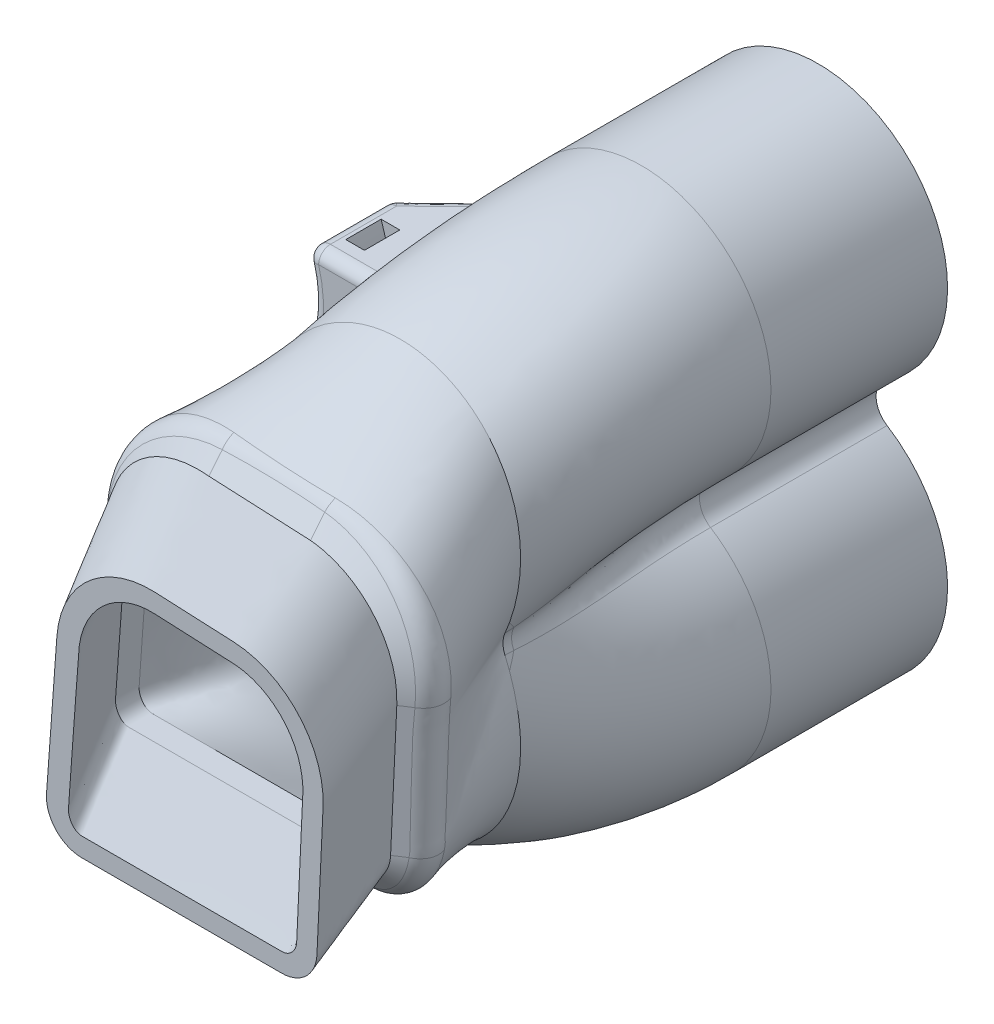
SolidWorks part; units mm, degrees
other "Твердое тело1[1]"
ref_plane "Спереди" through (0, 0, 0) normal (0, 0, 1) x (1, 0, 0)
ref_plane "Сверху" through (0, 0, 0) normal (0, 1, 0) x (1, 0, 0)
ref_plane "Справа" through (0, 0, 0) normal (1, 0, 0) x (0, 0, -1)
other "Configuration Table"
sketch "Эскиз1" plane through (0, 0, 0) normal (0, 0, 1) x (1, 0, 0)
  line L0 (-10.1901, -13.6844) -> (8.791, -13.6844)
  line L1 (13.7856, -8.9175) -> (14.3125, 2.3726)
  line L2 (4.7895, 12.8279) -> (-3.836, 13.2305)
  line L3 (-14.2753, 3.9727) -> (-15.1767, -8.3187)
  line L4 (-15.2035, -8.6844) -> (13.7965, -8.6844) construction
  line L5 (7.1965, -13.6844) -> (7.1965, 12.7156) construction
  line L6 (14.4965, 6.3156) -> (-14.1035, 6.3156) construction
  line L7 (-13.5631, 13.6844) -> (13.5631, -13.6844) construction
  arc A0 (8.791, -13.6844) -> (13.7856, -8.9175) centre (8.791, -8.6844) ccw
  arc A1 (-10.1901, -13.6844) -> (-15.1767, -8.3187) centre (-10.1901, -8.6844) cw
  arc A2 (-3.836, 13.2305) -> (-14.2753, 3.9727) centre (-4.3021, 3.2413) ccw
  arc A3 (14.3125, 2.3726) -> (4.7895, 12.8279) centre (4.3233, 2.8388) ccw
  point P8 (0, 0)
  dimension "D8" = 5
  dimension "D9" = 5
  dimension "D10" = 10
  dimension "D11" = 10
  dimension "D1" = 29
  dimension "D2" = 5
  dimension "D3" = 6.6
  dimension "D4" = 7.3
  dimension "D5" = 20
  dimension "D6" = 21.3
  dimension "D7" = 26.4
sketch "Эскиз14" plane through (0, 0, 0) normal (0, 0, 1) x (1, 0, 0)
  line L9 (-12.2807, 3.8264) -> (-13.1821, -8.465)
  line L10 (-10.1901, -11.6844) -> (8.791, -11.6844)
  line L11 (11.7878, -8.8242) -> (12.3146, 2.4659)
  line L12 (4.6963, 10.8301) -> (-3.9292, 11.2326)
  line L13 (-12.2807, 3.8264) -> (-13.1821, -8.465)
  line L14 (-10.1901, -11.6844) -> (8.791, -11.6844)
  line L15 (11.7878, -8.8242) -> (12.3146, 2.4659)
  line L16 (4.6963, 10.8301) -> (-3.9292, 11.2326)
  arc A8 (-13.1821, -8.465) -> (-10.1901, -11.6844) centre (-10.1901, -8.6844) ccw
  arc A9 (8.791, -11.6844) -> (11.7878, -8.8242) centre (8.791, -8.6844) ccw
  arc A10 (12.3146, 2.4659) -> (4.6963, 10.8301) centre (4.3233, 2.8388) ccw
  arc A11 (-3.9292, 11.2326) -> (-12.2807, 3.8264) centre (-4.3021, 3.2413) ccw
  arc A12 (-13.1821, -8.465) -> (-10.1901, -11.6844) centre (-10.1901, -8.6844) ccw
  arc A13 (8.791, -11.6844) -> (11.7878, -8.8242) centre (8.791, -8.6844) ccw
  arc A14 (12.3146, 2.4659) -> (4.6963, 10.8301) centre (4.3233, 2.8388) ccw
  arc A15 (-3.9292, 11.2326) -> (-12.2807, 3.8264) centre (-4.3021, 3.2413) ccw
  dimension "D1" = 2
sketch "Эскиз15" plane through (0, 0, 0) normal (0, 1, 0) x (1, 0, 0)
  line L0 (-12.5613, 0) -> (-6.5613, -10)
  line L1 (12.1996, 0) -> (12.1996, -10) construction
  line L2 (12.1996, -10) -> (16.1996, -10) construction
  line L3 (-12.5613, 0) -> (-12.5613, -10) construction
  line L4 (-12.5613, -10) -> (-6.5613, -10) construction
  line L5 (16.1996, -10) -> (12.1996, 0)
  dimension "D1" = 10
  dimension "D2" = 6
  dimension "D3" = 4
ref_plane "Плоскость6" through (0, 0, 10) normal (0, 0, 1) x (1, 0, 0)
sketch "Эскиз21" plane through (0, 0, 10) normal (0, 0, 1) x (1, 0, 0)
  line L0 (-10.1901, -11.6844) -> (8.791, -11.6844) construction
  line L1 (4.6963, 10.8301) -> (-3.9292, 11.2326) construction
  line L8 (15.7878, -8.8242) -> (16.306, 2.2796)
  line L9 (8.6876, 10.6438) -> (2.0503, 10.9536)
  line L10 (-6.3012, 3.5474) -> (-7.1821, -8.465)
  line L11 (-4.1901, -11.6844) -> (12.791, -11.6844)
  arc A8 (16.306, 2.2796) -> (8.6876, 10.6438) centre (8.3147, 2.6525) ccw
  arc A9 (2.0503, 10.9536) -> (-6.3012, 3.5474) centre (1.6774, 2.9623) ccw
  arc A10 (-7.1821, -8.465) -> (-4.1901, -11.6844) centre (-4.1901, -8.6844) ccw
  arc A11 (12.791, -11.6844) -> (15.7878, -8.8242) centre (12.791, -8.6844) ccw
  dimension "D1" = 8
  dimension "D2" = 8
  dimension "D3" = 3
  dimension "D4" = 3
  dimension "D6" = 85.806
  dimension "D8" = 92.672
loft "По сечениям4" add profiles "Эскиз21", "Эскиз14"
shell "Оболочка1" thickness 1.6
extrude "Бобышка-Вытянуть5" add sketch "Эскиз1" against normal blind 2
chamfer "Фаска2" distance 2 angle 54 8 edges at (-14.726, -2.173, 0) (-13.8526, -12.0882, 0) (-10.9371, 10.7231, 0) (-0.6995, -13.6844, 0) (0.4768, 13.0292, 0) (12.2432, -12.3014, 0) (11.7163, 9.5726, 0) (14.049, -3.2724, 0)
sketch "Эскиз16" plane through (0, 0, 0) normal (0, 0, 1) x (1, 0, 0)
  spline S1 degree 3 number of poles 102 (6.4508, 8.8632) -> (6.4508, 8.8632)
  spline S2 degree 3 number of poles 102 (6.4508, 8.8632) -> (6.4508, 8.8632)
  dimension "D1" = 0
extrude "Вырез-Вытянуть1" cut sketch "Эскиз16" against normal blind 2
sketch "Эскиз17" plane through (0, 0, 0) normal (0, 1, 0) x (1, 0, 0)
  line L0 (-15.1767, 2) -> (14.3125, 2) construction
  line L1 (-15.1767, 2) -> (10.2604, 12.1525)
  line L2 (10.2604, 12.1525) -> (14.3125, 2) construction
  line L4 (16.3145, -10) -> (12.1541, 0.424) construction
ref_plane "Плоскость3" through (0, 0, 0) normal (0, -1, 0) x (0.9288, 0, -0.3707)
ref_plane "Плоскость4" through (-2.774, 0, -6.9502) normal (-0.3707, 0, -0.9288) x (0.9288, 0, -0.3707)
ref_plane "Плоскость5" through (-6.4808, 0, -16.2378) normal (-0.3707, 0, -0.9288) x (0.9288, 0, -0.3707)
sketch "Эскиз18" plane through (-6.4808, 0, -16.2378) normal (-0.3707, 0, -0.9288) x (0.9288, 0, -0.3707)
  circle A0 centre (0, 0) radius 8
  circle A1 centre (0, 0) radius 6.4
  dimension "D1" = 16
  dimension "D2" = 1.6
sketch "Эскиз19" plane through (0, 0, -2) normal (0, 0, -1) x (-1, 0, 0)
  line L4 (-8.791, -13.6844) -> (10.1901, -13.6844)
  line L6 (-8.791, -13.6844) -> (10.1901, -13.6844)
  line L24 (15.1767, -8.3187) -> (14.2753, 3.9727)
  line L26 (15.1767, -8.3187) -> (14.2753, 3.9727)
  line L32 (3.836, 13.2305) -> (-4.7895, 12.8279)
  line L33 (3.836, 13.2305) -> (-4.7895, 12.8279)
  line L34 (-14.3125, 2.3726) -> (-13.7856, -8.9175)
  line L35 (-14.3125, 2.3726) -> (-13.7856, -8.9175)
  arc A4 (-13.7856, -8.9175) -> (-8.791, -13.6844) centre (-8.791, -8.6844) ccw
  arc A6 (-13.7856, -8.9175) -> (-8.791, -13.6844) centre (-8.791, -8.6844) ccw
  arc A20 (10.1901, -13.6844) -> (15.1767, -8.3187) centre (10.1901, -8.6844) ccw
  arc A22 (10.1901, -13.6844) -> (15.1767, -8.3187) centre (10.1901, -8.6844) ccw
  arc A28 (14.2753, 3.9727) -> (3.836, 13.2305) centre (4.3021, 3.2413) ccw
  arc A29 (14.2753, 3.9727) -> (3.836, 13.2305) centre (4.3021, 3.2413) ccw
  arc A30 (-4.7895, 12.8279) -> (-14.3125, 2.3726) centre (-4.3233, 2.8388) ccw
  arc A31 (-4.7895, 12.8279) -> (-14.3125, 2.3726) centre (-4.3233, 2.8388) ccw
  dimension "D1" = 0
sketch "Эскиз25" plane through (0, 0, -2) normal (0, 0, -1) x (-1, 0, 0)
  spline S1 degree 3 number of poles 103 (-6.4508, 8.8632) -> (-6.4508, 8.8632)
  spline S2 degree 3 number of poles 103 (-6.4508, 8.8632) -> (-6.4508, 8.8632)
  dimension "D1" = 0
imported_body "Импортированный1"
ref_plane "Плоскость7" through (50.5082, 29.1609, 0) normal (-0.866, -0.5, 0) x (0, 0, 1)
sketch "Эскиз22" plane through (50.5082, 29.1609, 0) normal (-0.866, -0.5, 0) x (0, 0, 1)
  circle A0 centre (38.5207, 40.0781) radius 44.5574
extrude "Вырез-Вытянуть2" cut sketch "Эскиз22" against normal through all
ref_plane "Плоскость8" through (0, 0, -12) normal (0, 0, -1) x (-1, 0, 0)
move or copy body "Тело-Переместить/Копировать1" bodies to move or copy 119 placed by mates yes parameters "D1"=0, "D2"=0, "D3"=0
move or copy body "Тело-Переместить/Копировать4" bodies to move or copy 120 copy no rotation origin (28.214, 62.9582, 0) rotation axis (0, 0, -1) rotation angle 120
move or copy body "Тело-Переместить/Копировать5" bodies to move or copy 123 placed by mates yes parameters "D1"=0, "D2"=0, "D3"=0
move or copy body "Тело-Переместить/Копировать6" bodies to move or copy 124 copy no translate (-27.576, 0, 0) parameters "D1"=27.576, "D2"=0, "D3"=0
sketch "Эскиз23" plane through (0, 0, -12) normal (0, 0, 1) x (1, 0, 0)
  spline S8 degree 3 poles (-475.1847, -2959.6305) (143.391, 3014.3151) (142.6745, -3014.3563) (-474.4803, 2959.7506) knots -48.361959 -48.361959 -48.361959 -48.361959 49.362504 49.362504 49.362504 49.362504 only from (-11.4821, 0.416) to (-11.4821, -0.4164)
  spline S9 degree 3 poles (97.9998, -2996.6284) (90.3479, 56.2211) (-8.2291, 25.6222) (-11.7485, -2.0174) (-11.7795, -2.4201) (-11.804, -3.2262) (-11.7974, -3.6297) (-11.7486, -4.4376) (-11.7059, -4.8435) (-11.5301, -6.0474) (-11.3507, -6.8326) (9.2131, -76.1636) (421.5135, -35.3531) (-2830.4983, -1016.9948) knots -8.340189 -8.340189 -8.340189 -8.340189 0.125 0.125 0.25 0.25 0.375 0.375 0.5 0.5 0.75 0.75 22.968042 22.968042 22.968042 22.968042 only from (-11.4821, -0.4164) to (-10.2923, -9.8784)
  spline S10 degree 3 poles (-1135.1289, -130.2086) (2332.7362, 1966.0536) (-101.5646, 136.8614) (-8.8364, -12.5452) (-8.3903, -13.1573) (-7.6438, -14.024) (-7.3808, -14.3055) (-6.8329, -14.8437) (-6.5491, -15.0994) (-5.6674, -15.8254) (-5.0393, -16.2546) (-4.0285, -16.8053) (-3.6798, -16.9733) (-2.9756, -17.2698) (-2.6182, -17.3996) (-1.5301, -17.7334) (-0.7823, -17.8828) (0.7555, -18.0161) (1.5163, -17.9971) (2.6448, -17.8367) (3.0189, -17.7614) (3.7628, -17.566) (4.1308, -17.446) (5.1988, -17.0288) (5.873, -16.6729) (6.8257, -16.0189) (7.1309, -15.7821) (7.7062, -15.2795) (7.9778, -15.0125) (8.4902, -14.4478) (8.7309, -14.1503) (9.182, -13.5252) (9.3899, -13.2007) (9.9574, -12.2041) (10.2646, -11.5045) (10.7409, -10.0372) (10.903, -9.2896) (11.0401, -8.1535) (11.0684, -7.7722) (11.0917, -7.0043) (11.0865, -6.6182) (11.0246, -5.4737) (10.9225, -4.7216) (-8.4306, 87.7233) (-843.0126, 33.179) (2890.0038, 797.8753) knots -14.391672 -14.391672 -14.391672 -14.391672 0.0625 0.0625 0.125 0.125 0.15625 0.15625 0.1875 0.1875 0.25 0.25 0.28125 0.28125 0.3125 0.3125 0.375 0.375 0.4375 0.4375 0.46875 0.46875 0.5 0.5 0.5625 0.5625 0.59375 0.59375 0.625 0.625 0.65625 0.65625 0.6875 0.6875 0.75 0.75 0.8125 0.8125 0.84375 0.84375 0.875 0.875 0.9375 0.9375 8.656348 8.656348 8.656348 8.656348 only from (-10.2923, -9.8784) to (10.1432, -1.7798)
  spline S11 degree 3 poles (2857.2917, 915.1964) (-3049.2236, -1398.9064) (3030.9413, 1303.2305) (-2820.3996, -987.7826) knots -240.936323 -240.936323 -240.936323 -240.936323 174.252904 174.252904 174.252904 174.252904 only from (10.1432, -1.7798) to (9.7544, -0.8031)
  spline S12 degree 3 poles (2932.6059, 673.8481) (205.6661, 14.6184) (12.9071, -16.3828) (9.6028, -0.2768) (9.5888, -0.1378) (9.5887, 0.1369) (9.6022, 0.2731) (12.1138, 12.615) (129.8111, 9.003) (326.3596, -2980.0497) knots -29.515141 -29.515141 -29.515141 -29.515141 0.25 0.25 0.5 0.5 0.75 0.75 23.351458 23.351458 23.351458 23.351458 only from (9.7544, -0.8031) to (9.7544, 0.8034)
  spline S13 degree 3 poles (-2820.2168, 988.4082) (3030.7027, -1303.9033) (-3048.9782, 1399.5945) (2857.163, -915.8405) knots -173.253799 -173.253799 -173.253799 -173.253799 241.938092 241.938092 241.938092 241.938092 only from (9.7544, 0.8034) to (10.1434, 1.78)
  spline S14 degree 3 poles (2890.126, -796.0581) (-878.8035, -32.9741) (-8.8354, -89.6337) (10.9213, 4.7168) (11.0234, 5.4673) (11.0856, 6.6091) (11.091, 6.9942) (11.0682, 7.7614) (11.0403, 8.1421) (10.9045, 9.2753) (10.7444, 10.0187) (10.3911, 11.1143) (10.2543, 11.4756) (9.9484, 12.1745) (9.609, 12.8539) (9.2016, 13.4941) (8.7583, 14.1135) (8.5173, 14.4144) (7.7451, 15.2724) (7.1744, 15.774) (6.2375, 16.4245) (5.9117, 16.6243) (5.232, 16.9885) (4.8836, 17.15) (3.8201, 17.5713) (3.0836, 17.7706) (1.5565, 17.996) (0.7947, 18.0165) (-0.3458, 17.9229) (-0.7266, 17.8706) (-1.483, 17.7252) (-1.8544, 17.6329) (-2.9495, 17.301) (-3.6561, 17.0056) (-5.0104, 16.2734) (-5.6409, 15.845) (-6.5253, 15.1204) (-6.8099, 14.8652) (-7.3591, 14.3282) (-7.6225, 14.0476) (-8.3723, 13.1806) (-8.8223, 12.566) (-33.3099, -26.7903) (108.41, -193.1924) (1466.6614, 2613.8231) knots -7.83156 -7.83156 -7.83156 -7.83156 0.0625 0.0625 0.125 0.125 0.15625 0.15625 0.1875 0.1875 0.25 0.25 0.28125 0.28125 0.3125 0.34375 0.34375 0.375 0.375 0.4375 0.4375 0.46875 0.46875 0.5 0.5 0.5625 0.5625 0.625 0.625 0.65625 0.65625 0.6875 0.6875 0.75 0.75 0.8125 0.8125 0.84375 0.84375 0.875 0.875 0.9375 0.9375 4.666451 4.666451 4.666451 4.666451 only from (10.1434, 1.78) to (-10.2923, 9.8779)
  spline S15 degree 3 poles (-2834.6592, 1005.1158) (426.2904, 36.72) (9.3117, 76.5113) (-11.351, 6.8308) (-11.5303, 6.0456) (-11.706, 4.8423) (-11.7488, 4.4355) (-11.7975, 3.6266) (-11.804, 3.223) (-11.7794, 2.4176) (-11.7484, 2.0158) (-7.5497, -30.963) (131.5433, -68.0091) (880.2331, 2860.4936) knots -22.076164 -22.076164 -22.076164 -22.076164 0.25 0.25 0.5 0.5 0.625 0.625 0.75 0.75 0.875 0.875 11.034305 11.034305 11.034305 11.034305 only from (-10.2923, 9.8779) to (-11.4821, 0.416)
  spline S16 degree 3 poles (-11.4821, 0.416) (-11.4174, 0.1428) (-11.4174, -0.1432) (-11.4821, -0.4164) knots 0 0 0 0 1 1 1 1
  spline S17 degree 3 poles (-11.4821, -0.4164) (-11.5742, -0.8101) (-11.6461, -1.213) (-11.7485, -2.0174) (-11.7795, -2.4201) (-11.804, -3.2262) (-11.7974, -3.6297) (-11.7486, -4.4376) (-11.7059, -4.8435) (-11.5301, -6.0474) (-11.3507, -6.8326) (-10.893, -8.3755) (-10.6146, -9.133) (-10.2923, -9.8784) knots 0 0 0 0 0.125 0.125 0.25 0.25 0.375 0.375 0.5 0.5 0.75 0.75 1 1 1 1
  spline S18 degree 3 poles (-10.2923, -9.8784) (-9.9869, -10.584) (-9.6349, -11.2587) (-8.8364, -12.5452) (-8.3903, -13.1573) (-7.6438, -14.024) (-7.3808, -14.3055) (-6.8329, -14.8437) (-6.5491, -15.0994) (-5.6674, -15.8254) (-5.0393, -16.2546) (-4.0285, -16.8053) (-3.6798, -16.9733) (-2.9756, -17.2698) (-2.6182, -17.3996) (-1.5301, -17.7334) (-0.7823, -17.8828) (0.7555, -18.0161) (1.5163, -17.9971) (2.6448, -17.8367) (3.0189, -17.7614) (3.7628, -17.566) (4.1308, -17.446) (5.1988, -17.0288) (5.873, -16.6729) (6.8257, -16.0189) (7.1309, -15.7821) (7.7062, -15.2795) (7.9778, -15.0125) (8.4902, -14.4478) (8.7309, -14.1503) (9.182, -13.5252) (9.3899, -13.2007) (9.9574, -12.2041) (10.2646, -11.5045) (10.7409, -10.0372) (10.903, -9.2896) (11.0401, -8.1535) (11.0684, -7.7722) (11.0917, -7.0043) (11.0865, -6.6182) (11.0246, -5.4737) (10.9225, -4.7216) (10.6116, -3.2366) (10.4027, -2.5037) (10.1432, -1.7798) knots 0 0 0 0 0.0625 0.0625 0.125 0.125 0.15625 0.15625 0.1875 0.1875 0.25 0.25 0.28125 0.28125 0.3125 0.3125 0.375 0.375 0.4375 0.4375 0.46875 0.46875 0.5 0.5 0.5625 0.5625 0.59375 0.59375 0.625 0.625 0.65625 0.65625 0.6875 0.6875 0.75 0.75 0.8125 0.8125 0.84375 0.84375 0.875 0.875 0.9375 0.9375 1 1 1 1
  spline S19 degree 3 poles (10.1432, -1.7798) (10.0247, -1.4496) (9.8952, -1.124) (9.7544, -0.8031) knots 0 0 0 0 1 1 1 1
  spline S20 degree 3 poles (9.7544, -0.8031) (9.6988, -0.676) (9.6579, -0.5451) (9.6028, -0.2768) (9.5888, -0.1378) (9.5887, 0.1369) (9.6022, 0.2731) (9.6572, 0.5432) (9.6988, 0.6763) (9.7544, 0.8034) knots 0 0 0 0 0.25 0.25 0.5 0.5 0.75 0.75 1 1 1 1
  spline S21 degree 3 poles (9.7544, 0.8034) (9.8953, 1.1242) (10.0248, 1.4498) (10.1434, 1.78) knots 0 0 0 0 1 1 1 1
  spline S22 degree 3 poles (10.1434, 1.78) (10.4024, 2.5028) (10.6109, 3.2345) (10.9213, 4.7168) (11.0234, 5.4673) (11.0856, 6.6091) (11.091, 6.9942) (11.0682, 7.7614) (11.0403, 8.1421) (10.9045, 9.2753) (10.7444, 10.0187) (10.3911, 11.1143) (10.2543, 11.4756) (9.9484, 12.1745) (9.609, 12.8539) (9.2016, 13.4941) (8.7583, 14.1135) (8.5173, 14.4144) (7.7451, 15.2724) (7.1744, 15.774) (6.2375, 16.4245) (5.9117, 16.6243) (5.232, 16.9885) (4.8836, 17.15) (3.8201, 17.5713) (3.0836, 17.7706) (1.5565, 17.996) (0.7947, 18.0165) (-0.3458, 17.9229) (-0.7266, 17.8706) (-1.483, 17.7252) (-1.8544, 17.6329) (-2.9495, 17.301) (-3.6561, 17.0056) (-5.0104, 16.2734) (-5.6409, 15.845) (-6.5253, 15.1204) (-6.8099, 14.8652) (-7.3591, 14.3282) (-7.6225, 14.0476) (-8.3723, 13.1806) (-8.8223, 12.566) (-9.6297, 11.2685) (-9.9868, 10.5838) (-10.2923, 9.8779) knots 0 0 0 0 0.0625 0.0625 0.125 0.125 0.15625 0.15625 0.1875 0.1875 0.25 0.25 0.28125 0.28125 0.3125 0.34375 0.34375 0.375 0.375 0.4375 0.4375 0.46875 0.46875 0.5 0.5 0.5625 0.5625 0.625 0.625 0.65625 0.65625 0.6875 0.6875 0.75 0.75 0.8125 0.8125 0.84375 0.84375 0.875 0.875 0.9375 0.9375 1 1 1 1
  spline S23 degree 3 poles (-10.2923, 9.8779) (-10.6148, 9.132) (-10.8934, 8.374) (-11.351, 6.8308) (-11.5303, 6.0456) (-11.706, 4.8423) (-11.7488, 4.4355) (-11.7975, 3.6266) (-11.804, 3.223) (-11.7794, 2.4176) (-11.7484, 2.0158) (-11.6463, 1.2142) (-11.5749, 0.8126) (-11.4821, 0.416) knots 0 0 0 0 0.25 0.25 0.5 0.5 0.625 0.625 0.75 0.75 0.875 0.875 1 1 1 1
  dimension "D1" = 0
sketch "Эскиз24" plane through (0, 0, -12) normal (0, 0, 1) x (1, 0, 0)
  spline S8 degree 3 poles (-506.3708, -2955.0795) (137.5377, 16.778) (-0.5705, 24.7724) (-8.5765, -1.4332) (-8.6618, -1.8033) (-8.8444, -2.9265) (-8.8694, -3.6991) (-8.7657, -5.2096) (-8.6388, -5.9543) (-8.352, -7.0577) (-8.2397, -7.4239) (26.2917, -105.3111) (1150.5664, 206.025) (-2678.9494, -1341.0481) knots -8.713357 -8.713357 -8.713357 -8.713357 0.125 0.125 0.25 0.25 0.5 0.5 0.75 0.75 0.875 0.875 34.763984 34.763984 34.763984 34.763984 only from (-8.0543, 0) to (-7.6879, -8.8463)
  spline S9 degree 3 poles (-2767.757, 1135.1469) (1433.198, -163.6336) (20.0851, 116.1973) (-8.5406, 6.333) (-8.6204, 5.9622) (-8.7459, 5.2111) (-8.7916, 4.8291) (-8.8692, 3.6893) (-8.8446, 2.9319) (-8.6607, 1.8005) (-8.5738, 1.425) (4.6659, -41.8319) (359.2274, 45.3598) (2838.4716, 942.0507) knots -37.106405 -37.106405 -37.106405 -37.106405 0.25 0.25 0.375 0.375 0.5 0.5 0.75 0.75 0.875 0.875 15.631374 15.631374 15.631374 15.631374 only from (-7.6884, 8.8461) to (-8.0543, 0)
  spline S10 degree 3 poles (3000.9621, 126.7815) (-631.3335, -186.7526) (23.7544, -53.9695) (7.8548, 9.2133) (7.7832, 9.4552) (7.6215, 9.927) (7.5311, 10.1581) (7.2304, 10.8366) (6.9909, 11.2694) (6.5661, 11.8857) (6.4126, 12.087) (6.0885, 12.4702) (5.9182, 12.6523) (5.3828, 13.1702) (4.9929, 13.4775) (4.3569, 13.8794) (4.1359, 14.0036) (3.6874, 14.2261) (3.2301, 14.4245) (2.7552, 14.5755) (2.2714, 14.7026) (2.0236, 14.7543) (1.2787, 14.8699) (0.7811, 14.8947) (-0.2156, 14.8446) (-0.7183, 14.7689) (-1.6883, 14.5293) (-2.1598, 14.3659) (-2.8473, 14.0575) (-3.073, 13.944) (-3.5104, 13.7003) (-3.7231, 13.5697) (-4.3442, 13.1533) (-4.7358, 12.843) (-5.4758, 12.1598) (-5.8164, 11.794) (-6.4426, 11.0193) (-6.7285, 10.6102) (-31.8913, -30.8467) (194.4854, -226.4304) (606.7502, 2936.3424) knots -7.964177 -7.964177 -7.964177 -7.964177 0.125 0.125 0.15625 0.15625 0.1875 0.1875 0.25 0.25 0.28125 0.28125 0.3125 0.3125 0.375 0.375 0.40625 0.40625 0.4375 0.46875 0.46875 0.5 0.5 0.5625 0.5625 0.625 0.625 0.6875 0.6875 0.71875 0.71875 0.75 0.75 0.8125 0.8125 0.875 0.875 0.9375 0.9375 6.910082 6.910082 6.910082 6.910082 only from (8.1879, 6.0042) to (-7.6884, 8.8461)
  spline S11 degree 3 poles (2907.4658, -753.1561) (-3070.1528, 567.0222) (3064.3707, -584.3733) (-2900.7467, 733.2541) knots -49.400459 -49.400459 -49.400459 -49.400459 41.208201 41.208201 41.208201 41.208201 only from (7.5367, 2.8129) to (8.1879, 6.0042)
  spline S12 degree 3 poles (-2537.9954, 1584.4395) (-592.8413, 261.4027) (-25.6098, -62.4856) (25.3682, 37.578) (-139.6233, 180.7214) (-1666.2281, -2477.7181) knots -67.20224 -67.20224 -67.20224 -67.20224 0.5 0.5 38.921301 38.921301 38.921301 38.921301 only from (6.1036, 0) to (7.5367, 2.8129)
  spline S13 degree 3 poles (2769.9971, 1086.2289) (-4185.5586, -2563.6275) (3677.5991, 2046.4799) (-2702.8546, -1282.8141) knots -124.804978 -124.804978 -124.804978 -124.804978 63.896309 63.896309 63.896309 63.896309 only from (7.5373, -2.8125) to (6.1036, 0)
  spline S14 degree 3 poles (-2990.4145, -68.1956) (-172.8027, -73.7542) (6.0125, -41.7714) (8.2127, -6.7765) (8.2069, -6.2769) (8.1275, -5.2768) (8.0531, -4.7735) (-6.7268, 64.369) (-616.4281, -22.5112) (2844.5766, 954.5975) knots -17.031638 -17.031638 -17.031638 -17.031638 0.25 0.25 0.5 0.5 0.75 0.75 35.334296 35.334296 35.334296 35.334296 only from (7.9688, -8.7709) to (7.5373, -2.8125)
  spline S15 degree 3 poles (-2598.567, -1509.5186) (474.5319, 486.3407) (-49.1618, 45.7406) (-6.0937, -11.4647) (-5.8083, -11.7997) (-5.1891, -12.4369) (-4.8598, -12.7343) (-4.1684, -13.2783) (-3.8053, -13.5262) (-3.0408, -13.9693) (-2.6367, -14.1647) (-1.8159, -14.484) (-1.3964, -14.6105) (-0.753, -14.7485) (-0.5361, -14.7858) (-0.0974, -14.8423) (0.1257, -14.8615) (0.7916, -14.8891) (1.2309, -14.8681) (2.1007, -14.7483) (2.5333, -14.649) (3.3798, -14.3703) (3.7843, -14.1946) (4.3633, -13.877) (4.5517, -13.762) (4.9188, -13.5138) (5.0986, -13.3798) (5.6143, -12.9574) (5.9291, -12.6481) (6.5038, -11.9776) (6.7656, -11.6127) (7.2196, -10.852) (7.4133, -10.4557) (18.8412, 18.4358) (-118.1838, 127.0593) (-1109.9954, -2787.9707) knots -10.030924 -10.030924 -10.030924 -10.030924 0.125 0.125 0.1875 0.1875 0.25 0.25 0.3125 0.3125 0.375 0.375 0.4375 0.4375 0.46875 0.46875 0.5 0.5 0.5625 0.5625 0.625 0.625 0.6875 0.6875 0.71875 0.71875 0.75 0.75 0.8125 0.8125 0.875 0.875 0.9375 0.9375 5.268157 5.268157 5.268157 5.268157 only from (-7.6879, -8.8463) to (7.9688, -8.7709)
  spline S16 degree 3 poles (-8.0543, 0) (-8.2155, -0.3436) (-8.3532, -0.7023) (-8.5765, -1.4332) (-8.6618, -1.8033) (-8.8444, -2.9265) (-8.8694, -3.6991) (-8.7657, -5.2096) (-8.6388, -5.9543) (-8.352, -7.0577) (-8.2397, -7.4239) (-7.9859, -8.1434) (-7.8442, -8.4976) (-7.6879, -8.8463) knots 0 0 0 0 0.125 0.125 0.25 0.25 0.5 0.5 0.75 0.75 0.875 0.875 1 1 1 1
  spline S17 degree 3 poles (-7.6884, 8.8461) (-8.0012, 8.1476) (-8.2542, 7.4322) (-8.5406, 6.333) (-8.6204, 5.9622) (-8.7459, 5.2111) (-8.7916, 4.8291) (-8.8692, 3.6893) (-8.8446, 2.9319) (-8.6607, 1.8005) (-8.5738, 1.425) (-8.3513, 0.6983) (-8.2156, 0.3443) (-8.0543, 0) knots 0 0 0 0 0.25 0.25 0.375 0.375 0.5 0.5 0.75 0.75 0.875 0.875 1 1 1 1
  spline S18 degree 3 poles (8.1879, 6.0042) (8.2453, 7.0083) (8.1608, 7.9975) (7.8548, 9.2133) (7.7832, 9.4552) (7.6215, 9.927) (7.5311, 10.1581) (7.2304, 10.8366) (6.9909, 11.2694) (6.5661, 11.8857) (6.4126, 12.087) (6.0885, 12.4702) (5.9182, 12.6523) (5.3828, 13.1702) (4.9929, 13.4775) (4.3569, 13.8794) (4.1359, 14.0036) (3.6874, 14.2261) (3.2301, 14.4245) (2.7552, 14.5755) (2.2714, 14.7026) (2.0236, 14.7543) (1.2787, 14.8699) (0.7811, 14.8947) (-0.2156, 14.8446) (-0.7183, 14.7689) (-1.6883, 14.5293) (-2.1598, 14.3659) (-2.8473, 14.0575) (-3.073, 13.944) (-3.5104, 13.7003) (-3.7231, 13.5697) (-4.3442, 13.1533) (-4.7358, 12.843) (-5.4758, 12.1598) (-5.8164, 11.794) (-6.4426, 11.0193) (-6.7285, 10.6102) (-7.2497, 9.7515) (-7.4828, 9.3052) (-7.6884, 8.8461) knots 0 0 0 0 0.125 0.125 0.15625 0.15625 0.1875 0.1875 0.25 0.25 0.28125 0.28125 0.3125 0.3125 0.375 0.375 0.40625 0.40625 0.4375 0.46875 0.46875 0.5 0.5 0.5625 0.5625 0.625 0.625 0.6875 0.6875 0.71875 0.71875 0.75 0.75 0.8125 0.8125 0.875 0.875 0.9375 0.9375 1 1 1 1
  spline S19 degree 3 poles (7.5367, 2.8129) (7.8972, 3.8474) (8.1251, 4.909) (8.1879, 6.0042) knots 0 0 0 0 1 1 1 1
  spline S20 degree 3 poles (6.1036, 0) (6.4024, 0.4289) (6.6718, 0.8792) (7.1521, 1.8221) (7.3613, 2.3117) (7.5367, 2.8129) knots 0 0 0 0 0.5 0.5 1 1 1 1
  spline S21 degree 3 poles (7.5373, -2.8125) (7.1845, -1.8053) (6.708, -0.867) (6.1036, 0) knots 0 0 0 0 1 1 1 1
  spline S22 degree 3 poles (7.9688, -8.7709) (8.0816, -8.273) (8.1499, -7.7745) (8.2127, -6.7765) (8.2069, -6.2769) (8.1275, -5.2768) (8.0531, -4.7735) (7.841, -3.781) (7.7038, -3.2929) (7.5373, -2.8125) knots 0 0 0 0 0.25 0.25 0.5 0.5 0.75 0.75 1 1 1 1
  spline S23 degree 3 poles (-7.6879, -8.8463) (-7.325, -9.6571) (-6.8839, -10.415) (-6.0937, -11.4647) (-5.8083, -11.7997) (-5.1891, -12.4369) (-4.8598, -12.7343) (-4.1684, -13.2783) (-3.8053, -13.5262) (-3.0408, -13.9693) (-2.6367, -14.1647) (-1.8159, -14.484) (-1.3964, -14.6105) (-0.753, -14.7485) (-0.5361, -14.7858) (-0.0974, -14.8423) (0.1257, -14.8615) (0.7916, -14.8891) (1.2309, -14.8681) (2.1007, -14.7483) (2.5333, -14.649) (3.3798, -14.3703) (3.7843, -14.1946) (4.3633, -13.877) (4.5517, -13.762) (4.9188, -13.5138) (5.0986, -13.3798) (5.6143, -12.9574) (5.9291, -12.6481) (6.5038, -11.9776) (6.7656, -11.6127) (7.2196, -10.852) (7.4133, -10.4557) (7.7384, -9.6337) (7.8701, -9.206) (7.9688, -8.7709) knots 0 0 0 0 0.125 0.125 0.1875 0.1875 0.25 0.25 0.3125 0.3125 0.375 0.375 0.4375 0.4375 0.46875 0.46875 0.5 0.5 0.5625 0.5625 0.625 0.625 0.6875 0.6875 0.71875 0.71875 0.75 0.75 0.8125 0.8125 0.875 0.875 0.9375 0.9375 1 1 1 1
  dimension "D1" = 0
sketch3d "Трехмерный эскиз1"
  line L0 (9.5888, 0, -12) -> (14.2017, 0, -2)
  line L1 (14.3125, 2.3726, -2) -> (13.7856, -8.9175, -2) construction
  line L2 (-11.4336, 0, -12) -> (-14.5667, 0, -2)
  line L3 (-15.1767, -8.3187, -2) -> (-14.2753, 3.9727, -2) construction
  spline S0 degree 3 poles (9.7544, -0.8031, -12) (9.6988, -0.676, -12) (9.6579, -0.5451, -12) (9.6028, -0.2768, -12) (9.5888, -0.1378, -12) (9.5887, 0.1369, -12) (9.6022, 0.2731, -12) (9.6572, 0.5432, -12) (9.6988, 0.6763, -12) (9.7544, 0.8034, -12) knots 0 0 0 0 0.25 0.25 0.5 0.5 0.75 0.75 1 1 1 1 construction
  spline S1 degree 3 poles (-11.4821, 0.416, -12) (-11.4174, 0.1428, -12) (-11.4174, -0.1432, -12) (-11.4821, -0.4164, -12) knots 0 0 0 0 1 1 1 1 construction
  point P12 (-11.4339, -0.037, -12)
sketch3d "Трехмерный эскиз3"
  line L0 (8.791, -13.6844, -2) -> (8.2181, -14.7476, -12)
  line L1 (11.7163, 9.5726, -2) -> (10.4297, 10.9857, -12)
  arc A0 (4.7895, 12.8279, -2) -> (14.3125, 2.3726, -2) centre (4.3233, 2.8388, -2) ccw construction
  spline S2 degree 3 poles (-10.2923, -9.8784, -12) (-9.9869, -10.584, -12) (-9.6349, -11.2587, -12) (-8.8364, -12.5452, -12) (-8.3903, -13.1573, -12) (-7.6438, -14.024, -12) (-7.3808, -14.3055, -12) (-6.8329, -14.8437, -12) (-6.5491, -15.0994, -12) (-5.6674, -15.8254, -12) (-5.0393, -16.2546, -12) (-4.0285, -16.8053, -12) (-3.6798, -16.9733, -12) (-2.9756, -17.2698, -12) (-2.6182, -17.3996, -12) (-1.5301, -17.7334, -12) (-0.7823, -17.8828, -12) (0.7555, -18.0161, -12) (1.5163, -17.9971, -12) (2.6448, -17.8367, -12) (3.0189, -17.7614, -12) (3.7628, -17.566, -12) (4.1308, -17.446, -12) (5.1988, -17.0288, -12) (5.873, -16.6729, -12) (6.8257, -16.0189, -12) (7.1309, -15.7821, -12) (7.7062, -15.2795, -12) (7.9778, -15.0125, -12) (8.4902, -14.4478, -12) (8.7309, -14.1503, -12) (9.182, -13.5252, -12) (9.3899, -13.2007, -12) (9.9574, -12.2041, -12) (10.2646, -11.5045, -12) (10.7409, -10.0372, -12) (10.903, -9.2896, -12) (11.0401, -8.1535, -12) (11.0684, -7.7722, -12) (11.0917, -7.0043, -12) (11.0865, -6.6182, -12) (11.0246, -5.4737, -12) (10.9225, -4.7216, -12) (10.6116, -3.2366, -12) (10.4027, -2.5037, -12) (10.1432, -1.7798, -12) knots 0 0 0 0 0.0625 0.0625 0.125 0.125 0.15625 0.15625 0.1875 0.1875 0.25 0.25 0.28125 0.28125 0.3125 0.3125 0.375 0.375 0.4375 0.4375 0.46875 0.46875 0.5 0.5 0.5625 0.5625 0.59375 0.59375 0.625 0.625 0.65625 0.65625 0.6875 0.6875 0.75 0.75 0.8125 0.8125 0.84375 0.84375 0.875 0.875 0.9375 0.9375 1 1 1 1 construction
  spline S3 degree 3 poles (10.1434, 1.78, -12) (10.4024, 2.5028, -12) (10.6109, 3.2345, -12) (10.9213, 4.7168, -12) (11.0234, 5.4673, -12) (11.0856, 6.6091, -12) (11.091, 6.9942, -12) (11.0682, 7.7614, -12) (11.0403, 8.1421, -12) (10.9045, 9.2753, -12) (10.7444, 10.0187, -12) (10.3911, 11.1143, -12) (10.2543, 11.4756, -12) (9.9484, 12.1745, -12) (9.609, 12.8539, -12) (9.2016, 13.4941, -12) (8.7583, 14.1135, -12) (8.5173, 14.4144, -12) (7.7451, 15.2724, -12) (7.1744, 15.774, -12) (6.2375, 16.4245, -12) (5.9117, 16.6243, -12) (5.232, 16.9885, -12) (4.8836, 17.15, -12) (3.8201, 17.5713, -12) (3.0836, 17.7706, -12) (1.5565, 17.996, -12) (0.7947, 18.0165, -12) (-0.3458, 17.9229, -12) (-0.7266, 17.8706, -12) (-1.483, 17.7252, -12) (-1.8544, 17.6329, -12) (-2.9495, 17.301, -12) (-3.6561, 17.0056, -12) (-5.0104, 16.2734, -12) (-5.6409, 15.845, -12) (-6.5253, 15.1204, -12) (-6.8099, 14.8652, -12) (-7.3591, 14.3282, -12) (-7.6225, 14.0476, -12) (-8.3723, 13.1806, -12) (-8.8223, 12.566, -12) (-9.6297, 11.2685, -12) (-9.9868, 10.5838, -12) (-10.2923, 9.8779, -12) knots 0 0 0 0 0.0625 0.0625 0.125 0.125 0.15625 0.15625 0.1875 0.1875 0.25 0.25 0.28125 0.28125 0.3125 0.34375 0.34375 0.375 0.375 0.4375 0.4375 0.46875 0.46875 0.5 0.5 0.5625 0.5625 0.625 0.625 0.65625 0.65625 0.6875 0.6875 0.75 0.75 0.8125 0.8125 0.84375 0.84375 0.875 0.875 0.9375 0.9375 1 1 1 1 construction
  point P3 (8.2191, -14.7485, -12)
  point P10 (4.3233, 2.8388, -12)
  point P11 (10.431, 10.9862, -12)
sketch3d "Трехмерный эскиз4"
  line L0 (-10.2923, 9.8779, -12) -> (-10.9371, 10.7231, -2)
  line L1 (-13.9914, -11.9324, -2) -> (-10.2923, -9.8784, -12)
  arc A0 (-14.2753, 3.9727, -2) -> (-3.836, 13.2305, -2) centre (-4.3021, 3.2413, -2) ccw construction
  arc A2 (-10.1901, -13.6844, -2) -> (-15.1767, -8.3187, -2) centre (-10.1901, -8.6844, -2) ccw construction
  spline S0 degree 3 poles (-11.4821, -0.4164, -12) (-11.5742, -0.8101, -12) (-11.6461, -1.213, -12) (-11.7485, -2.0174, -12) (-11.7795, -2.4201, -12) (-11.804, -3.2262, -12) (-11.7974, -3.6297, -12) (-11.7486, -4.4376, -12) (-11.7059, -4.8435, -12) (-11.5301, -6.0474, -12) (-11.3507, -6.8326, -12) (-10.893, -8.3755, -12) (-10.6146, -9.133, -12) (-10.2923, -9.8784, -12) knots 0 0 0 0 0.125 0.125 0.25 0.25 0.375 0.375 0.5 0.5 0.75 0.75 1 1 1 1 construction
  point P6 (-4.3021, 3.2413, -12)
  point P12 (-10.1901, -8.6844, -7)
  point P13 (-13.9914, -11.9324, -2)
loft "По сечениям6" add profiles "Эскиз19", "Эскиз23"
loft "Вырез-По сечениям3" cut profiles "Эскиз24", "Эскиз25"
fillet "Скругление2" radius 2 8 edges at (11.8958, -12.6036, -2) (-14.4423, -11.3146, -1.9999) (-10.1739, 11.3358, -2) (12.7581, 8.2105, -2)
